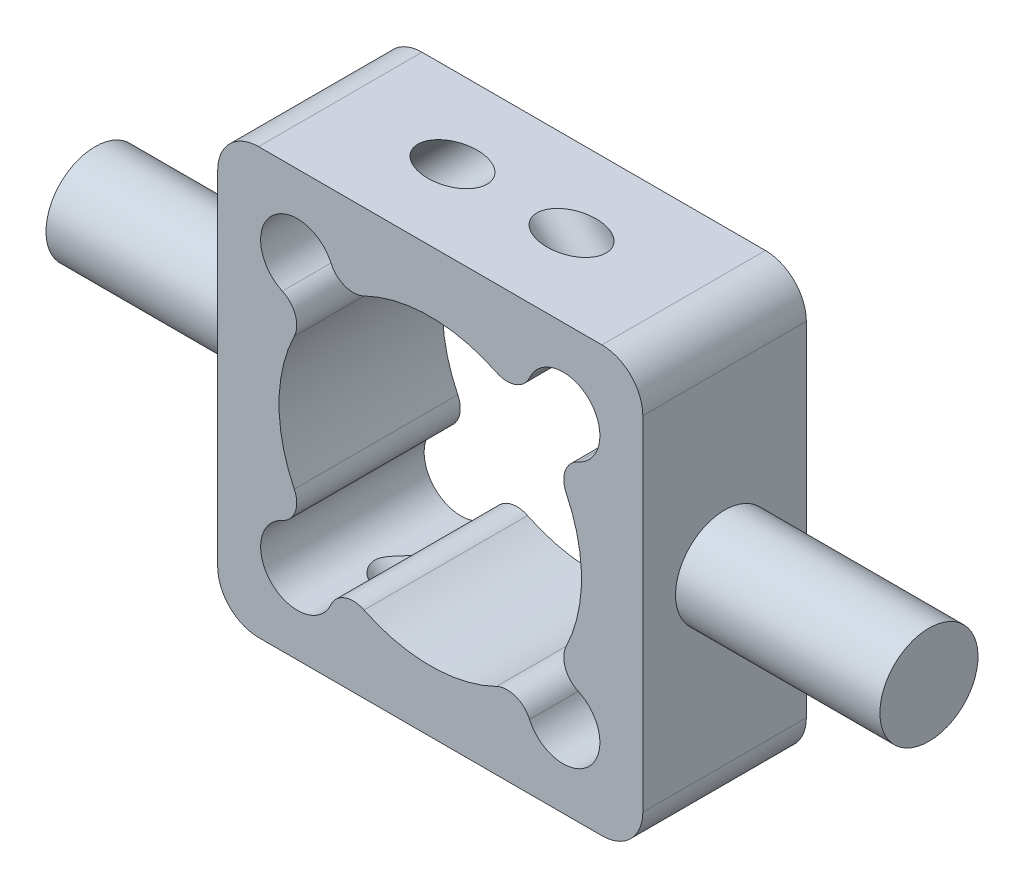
SolidWorks part; units mm, degrees
ref_plane "Plano frontal" through (0, 0, 0) normal (0, 0, 1) x (1, 0, 0)
ref_plane "Plano superior" through (0, 0, 0) normal (0, 1, 0) x (1, 0, 0)
ref_plane "Plano direito" through (0, 0, 0) normal (1, 0, 0) x (0, 0, -1)
sketch "Esboço1" plane through (0, 0, 0) normal (0, 0, 1) x (1, 0, 0)
  line L0 (0, 24.4094) -> (0, -31.769) construction
  line L1 (-26, 26) -> (26, 26)
  line L2 (-26, 26) -> (-26, -26)
  line L3 (-26, -26) -> (26, -26)
  line L4 (26, 26) -> (26, -26)
  line L5 (-35.6169, 0) -> (36.185, 0) construction
  arc A0 (-16.6332, 8.0985) -> (-16.6332, -8.0985) centre (0, 0) ccw
  arc A1 (-12.1471, 18.0983) -> (-18.0983, 12.1471) centre (-16.25, 16.25) ccw
  arc A2 (18.0983, 12.1471) -> (12.1471, 18.0983) centre (16.25, 16.25) ccw
  arc A3 (12.1471, -18.0983) -> (18.0983, -12.1471) centre (16.25, -16.25) ccw
  arc A4 (-18.0983, -12.1471) -> (-12.1471, -18.0983) centre (-16.25, -16.25) ccw
  arc A5 (8.0985, 16.6332) -> (-8.0985, 16.6332) centre (0, 0) ccw
  arc A6 (16.6332, -8.0985) -> (16.6332, 8.0985) centre (0, 0) ccw
  arc A7 (-8.0985, -16.6332) -> (8.0985, -16.6332) centre (0, 0) ccw
  arc A8 (-12.1471, 18.0983) -> (-8.0985, 16.6332) centre (-9.4118, 19.3305) ccw
  arc A9 (-16.6332, 8.0985) -> (-18.0983, 12.1471) centre (-19.3305, 9.4118) ccw
  arc A10 (-8.0985, -16.6332) -> (-12.1471, -18.0983) centre (-9.4118, -19.3305) ccw
  arc A11 (-18.0983, -12.1471) -> (-16.6332, -8.0985) centre (-19.3305, -9.4118) ccw
  arc A12 (8.0985, -16.6332) -> (12.1471, -18.0983) centre (9.4118, -19.3305) cw
  arc A13 (16.6332, -8.0985) -> (18.0983, -12.1471) centre (19.3305, -9.4118) ccw
  arc A14 (16.6332, 8.0985) -> (18.0983, 12.1471) centre (19.3305, 9.4118) cw
  arc A15 (8.0985, 16.6332) -> (12.1471, 18.0983) centre (9.4118, 19.3305) ccw
  point P28 (-12.8166, -13.3411)
  point P35 (13.3411, -12.8166)
  point P40 (12.8166, 13.3411)
  dimension "D2" = 37
  dimension "D4" = 9
  dimension "D6" = 3
  dimension "D1" = 52
  dimension "D3" = 32.5
  dimension "D5" = 32.5
extrude "Extrusão1" add sketch "Esboço1" along normal blind 20
sketch "Esboço2" plane through (-26, 0, 0) normal (-1, 0, 0) x (0, 0, 1)
  line L0 (10, 26) -> (10, -26) construction
  line L1 (20, 26) -> (0, 26) construction
  line L2 (20, -26) -> (0, -26) construction
  line L3 (0, 0) -> (20, 0) construction
  line L4 (0, 26) -> (0, -26) construction
  line L5 (20, 26) -> (20, -26) construction
  circle A0 centre (10, 0) radius 6
  dimension "D1" = 12
extrude "Extrusão2" add sketch "Esboço2" along normal blind 25
mirror "Espelhar1" about plane through (0, 0, 0) normal (1, 0, 0) of "Extrusão2"
fillet "Filete2" radius 5 4 edges at (-26, 26, 10) (26, 26, 10) (26, -26, 10) (-26, -26, 10)
ref_plane "Plano1" through (0, 0, 0) normal (1, 0, 0) x (0, 0, -1)
ref_plane "Plano2" through (2.9756, -2.9756, 0) normal (0.7071, -0.7071, 0) x (0.7071, 0.7071, 0)
ref_plane "Plano3" through (-18.2376, 18.2376, 0) normal (0.7071, -0.7071, 0) x (0.7071, 0.7071, 0)
sketch "Esboço6" plane through (-18.2376, 18.2376, 0) normal (0.7071, -0.7071, 0) x (0.7071, 0.7071, 0)
  line L0 (31.9952, 10) -> (-1.9393, 10) construction
  line L1 (33.234, 0) -> (3.5355, 0) construction
  line L2 (33.234, 20) -> (3.5355, 20) construction
  line L3 (3.5355, 0) -> (3.5355, 20) construction
  circle A0 centre (23.5355, 10) radius 3
  dimension "D1" = 6
  dimension "D2" = 20
extrude "Extrusão5" cut sketch "Esboço6" along normal blind 25
mirror "Espelhar2" about plane through (0, 0, 0) normal (1, 0, 0) of "Extrusão5"
mirror "Espelhar3" about plane through (0, 0, 0) normal (0, 1, 0) of "Espelhar2", "Extrusão5"
